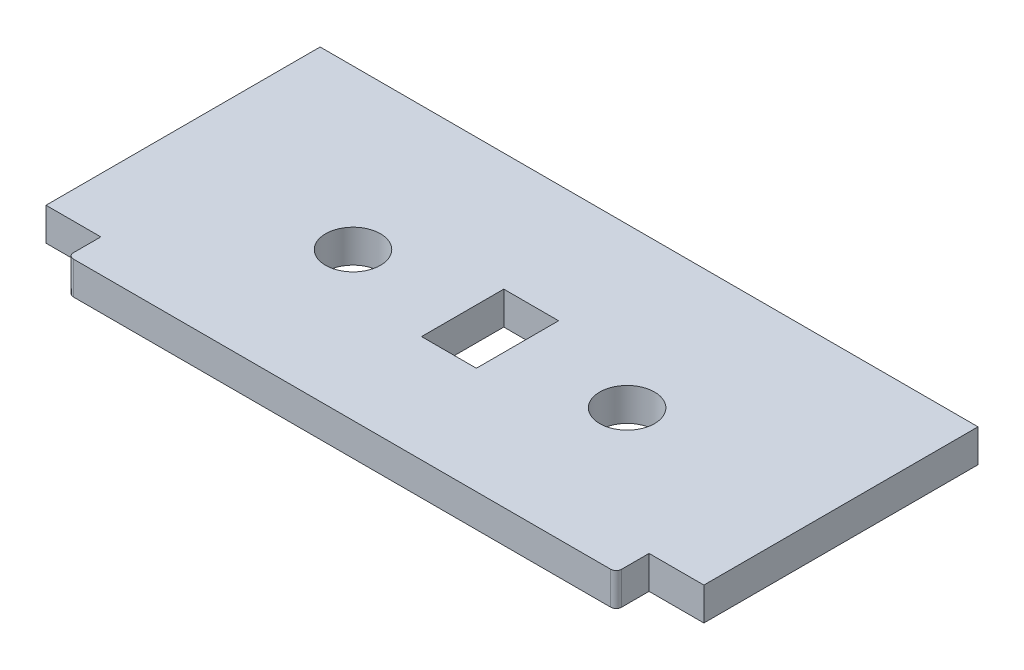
SolidWorks part; units mm, degrees
ref_plane "Front Plane" through (0, 0, 0) normal (0, 0, 1) x (1, 0, 0)
ref_plane "Top Plane" through (0, 0, 0) normal (0, 1, 0) x (1, 0, 0)
ref_plane "Right Plane" through (0, 0, 0) normal (1, 0, 0) x (0, 0, -1)
sketch "Sketch1" plane through (0, 0, 0) normal (0, 1, 0) x (1, 0, 0)
  line L1 (-60, 25) -> (60, 25)
  line L2 (-60, 25) -> (-60, -25)
  line L3 (-60, -25) -> (-50, -25)
  line L4 (60, 25) -> (60, -25)
  line L8 (-50, -25) -> (-50, -31)
  line L9 (-5, 3.5) -> (5, 3.5)
  line L10 (-5, 3.5) -> (-5, -11.5)
  line L11 (-5, -11.5) -> (5, -11.5)
  line L12 (5, 3.5) -> (5, -11.5)
  line L15 (-50, -31) -> (50, -31)
  line L16 (50, -31) -> (50, -25)
  line L17 (50, -25) -> (60, -25)
  line L18 (22, 0) -> (28, 0) construction
  circle A1 centre (-25, -4) radius 5
  circle A2 centre (25, -4) radius 5
  point P0 (0, 0)
  point P14 (0, -4)
  dimension "D3" = 21
  dimension "D1" = 50
  dimension "D2" = 120
  dimension "D5" = 10
  dimension "D6" = 15
  dimension "D7" = 100
  dimension "D8" = 10
  dimension "D9" = 6
extrude "Boss-Extrude1" add sketch "Sketch1" along normal blind 6
fillet "Fillet1" radius 1 2 edges at (-50, 3, 31) (50, 3, 31)
